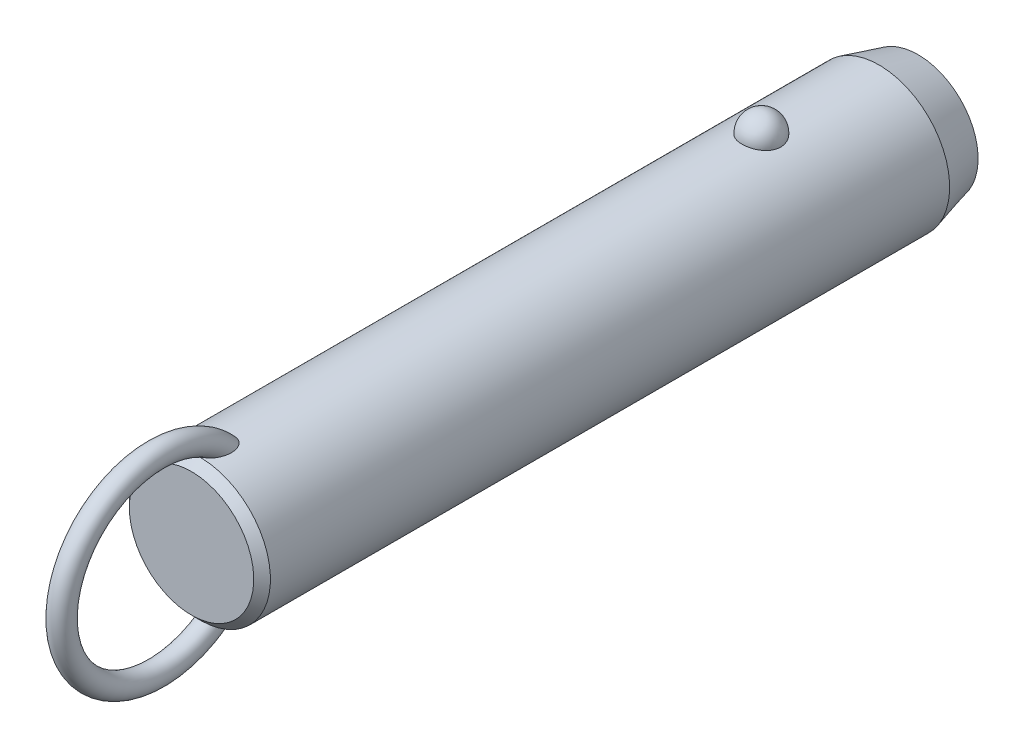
SolidWorks part; units mm, degrees
ref_plane "Front Plane" through (0, 0, 0) normal (0, 0, 1) x (1, 0, 0)
ref_plane "Top Plane" through (0, 0, 0) normal (0, 1, 0) x (1, 0, 0)
ref_plane "Right Plane" through (0, 0, 0) normal (1, 0, 0) x (0, 0, -1)
sketch "Sketch2" plane through (0, 0, 0) normal (0, 0, 1) x (1, 0, 0)
  circle A0 centre (0, 0) radius 12.7
  point P3 (0, 12.7)
  dimension "D1" = 25.4
extrude "Boss-Extrude1" add sketch "Sketch2" along normal blind 86.4
sketch "Sketch3" plane through (0, 0, 0) normal (0, 0, -1) x (-1, 0, 0)
  circle A0 centre (0, 0) radius 12.7
  dimension "D1" = 25.4
extrude "Boss-Extrude2" add sketch "Sketch3" along normal blind 31.7
chamfer "Chamfer1" distance 7 angle 15 1 edges at (-12.7, 0, -31.7)
sketch "Sketch12" plane through (0, 0, 0) normal (1, 0, 0) x (0, 0, -1)
  line L0 (-86.4, 12.7) -> (-86.4, -12.7) construction
  point P0 (-86.4, 0)
sketch "Sketch13" plane through (0, 0, 0) normal (1, 0, 0) x (0, 0, -1)
  circle A0 centre (-105.45, 0) radius 19.05
  point P2 (-86.4, 0)
  dimension "D1" = 38.1
sketch "Sketch14" plane through (0, 0, 0) normal (0, 1, 0) x (1, 0, 0)
  circle A0 centre (0, -88.4) radius 2
  point P2 (0, -86.4)
  dimension "D1" = 4
sweep "Sweep1" add profiles "Sketch14" path "Sketch13"
sketch "Sketch15" plane through (0, 0, 86.4) normal (0, 0, 1) x (1, 0, 0)
  circle A0 centre (0, 0) radius 12.7
  dimension "D1" = 25.4
extrude "Boss-Extrude3" add sketch "Sketch15" along normal blind 12.7
chamfer "Chamfer2" distance 1.5 angle 45 1 edges at (12.7, 0, 99.1)
sketch "Sketch18" plane through (0, 0, 0) normal (1, 0, 0) x (0, 0, -1)
  line L0 (24.7, 12.7) -> (-91.251, 12.7) construction
  line L1 (3.5, 16.2) -> (3.5, 9.2)
  line L2 (-91.251, -12.7) -> (24.7, -12.7) construction
  arc A0 (3.5, 16.2) -> (3.5, 9.2) centre (3.5, 12.7) ccw
  point P4 (0, 12.7)
  dimension "D1" = 28.9
revolve "Revolve1" add sketch "Sketch18" angle 360 about L1
